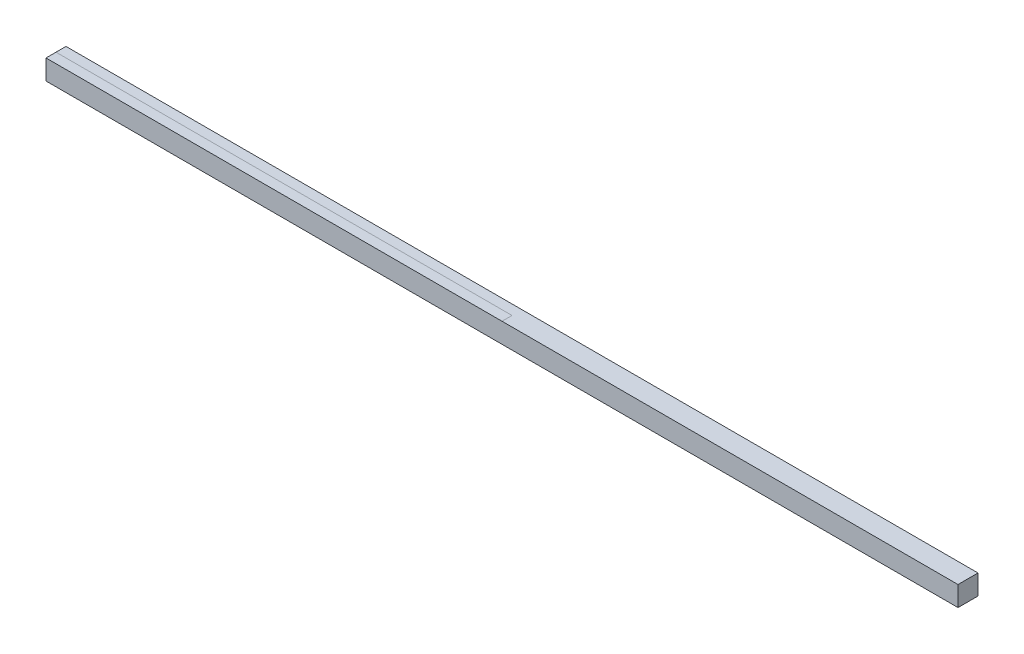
SolidWorks part; units mm, degrees
ref_plane "Front Plane" through (0, 0, 0) normal (0, 0, 1) x (1, 0, 0)
ref_plane "Top Plane" through (0, 0, 0) normal (0, 1, 0) x (1, 0, 0)
ref_plane "Right Plane" through (0, 0, 0) normal (1, 0, 0) x (0, 0, -1)
sketch "Sketch1" plane through (0, 0, 0) normal (0, 0, 1) x (1, 0, 0)
  line L0 (0, 0) -> (0, 245.759) construction
  line L1 (-579.365, 25.4) -> (579.365, 25.4)
  line L2 (-579.365, 25.4) -> (-579.365, 0)
  line L3 (-579.365, 0) -> (579.365, 0)
  line L4 (579.365, 25.4) -> (579.365, 0)
  dimension "D1" = 1158.73
  dimension "D2" = 25.4
extrude "Extrude1" add sketch "Sketch1" along normal mid plane 25.4
sketch "Sketch2" plane through (0, 25.4, 0) normal (0, 1, 0) x (-1, 0, 0)
  line L1 (0, 0) -> (592.6485, 0)
  line L2 (0, 0) -> (0, 154.7309)
  line L3 (0, 154.7309) -> (592.6485, 154.7309)
  line L4 (592.6485, 0) -> (592.6485, 154.7309)
